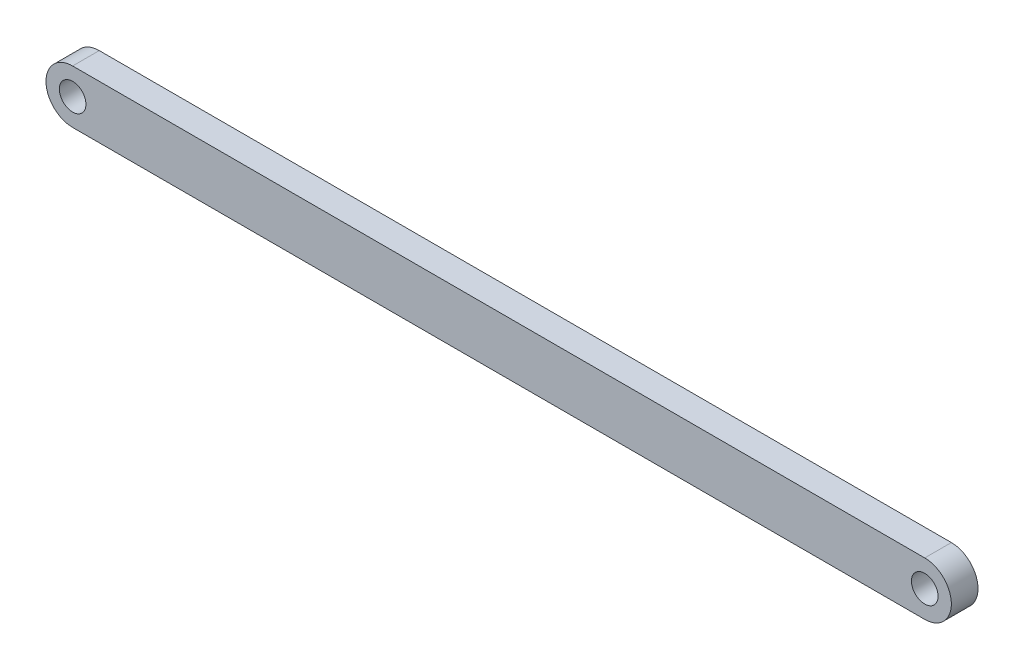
SolidWorks part; units mm, degrees
ref_plane "Front Plane" through (0, 0, 0) normal (0, 0, 1) x (1, 0, 0)
ref_plane "Top Plane" through (0, 0, 0) normal (0, 1, 0) x (1, 0, 0)
ref_plane "Right Plane" through (0, 0, 0) normal (1, 0, 0) x (0, 0, -1)
sketch "Sketch1" plane through (0, 0, 0) normal (0, 0, 1) x (1, 0, 0)
  line L0 (0, 0) -> (101.6, 0) construction
  line L1 (0, 3.175) -> (101.6, 3.175)
  line L2 (0, -3.175) -> (101.6, -3.175)
  arc A0 (0, 3.175) -> (0, -3.175) centre (0, 0) ccw
  arc A1 (101.6, -3.175) -> (101.6, 3.175) centre (101.6, 0) ccw
  circle A2 centre (0, 0) radius 1.5875
  circle A3 centre (101.6, 0) radius 1.5875
  point P3 (50.8, 0)
  dimension "D1" = 3.175
  dimension "D3" = 3.175
  dimension "D2" = 101.6
extrude "Boss-Extrude1" add sketch "Sketch1" along normal blind 3.175
